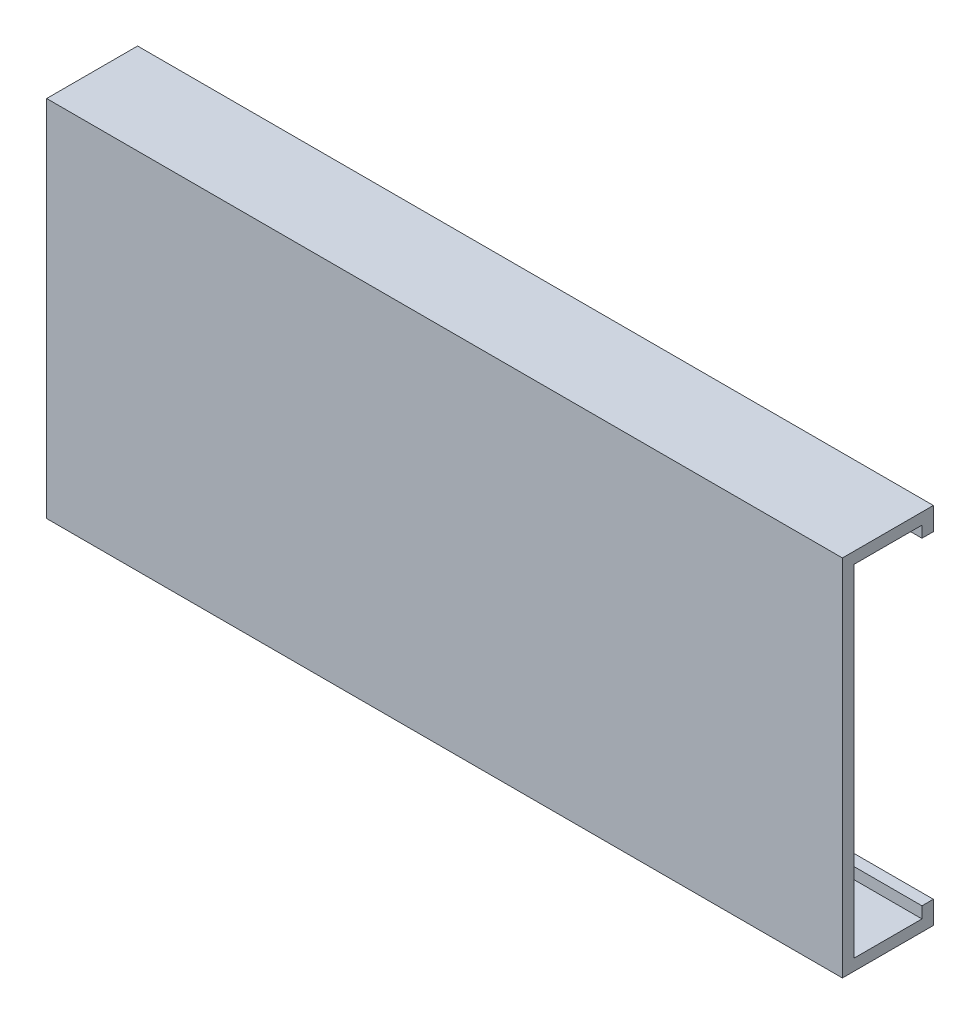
SolidWorks part; units mm, degrees
ref_plane "Front Plane" through (0, 0, 0) normal (0, 0, 1) x (1, 0, 0)
ref_plane "Top Plane" through (0, 0, 0) normal (0, 1, 0) x (1, 0, 0)
ref_plane "Right Plane" through (0, 0, 0) normal (1, 0, 0) x (0, 0, -1)
sketch "Sketch1" plane through (0, 0, 0) normal (0, 0, 1) x (1, 0, 0)
  line L1 (-35, -15) -> (35, -15)
  line L2 (-35, -15) -> (-35, 15)
  line L3 (-35, 15) -> (35, 15)
  line L4 (35, -15) -> (35, 15)
  line L5 (-35, -15) -> (35, 15) construction
  line L6 (-35, 15) -> (35, -15) construction
  point P0 (0, 0)
  dimension "D1" = 30
  dimension "D2" = 70
extrude "Boss-Extrude1" add sketch "Sketch1" along normal blind 1
sketch "Sketch2" plane through (0, 15, 0) normal (0, 1, 0) x (1, 0, 0)
  line L0 (35, -1) -> (35, 0) construction
  line L1 (-35, -1) -> (35, -1)
  line L2 (-35, -1) -> (-35, 7)
  line L3 (-35, 7) -> (35, 7)
  line L4 (35, -1) -> (35, 7)
  dimension "D1" = 8
extrude "Boss-Extrude2" add sketch "Sketch2" along normal blind 1 contours L3 L4 L1 L2
sketch "Sketch3" plane through (0, 0, 0) normal (0, 0, -1) x (-1, 0, 0)
  line L0 (35, 15) -> (35, -15) construction
  line L1 (-35, -15) -> (35, -15)
  line L2 (-35, -15) -> (-35, -16)
  line L3 (-35, -16) -> (35, -16)
  line L4 (35, -15) -> (35, -16)
  dimension "D1" = 1
extrude "Boss-Extrude3" add sketch "Sketch3" along normal blind 7 and the other way blind 1
sketch "Sketch4" plane through (35, 0, 0) normal (1, 0, 0) x (0, 0, -1)
  line L0 (0, -15) -> (7, -15) construction
  line L1 (7, 15) -> (6, 15)
  line L2 (7, 15) -> (7, 14)
  line L3 (7, 14) -> (6, 14)
  line L4 (6, 15) -> (6, 14)
  line L5 (7, -15) -> (6, -15)
  line L6 (7, -15) -> (7, -14)
  line L7 (7, -14) -> (6, -14)
  line L8 (6, -15) -> (6, -14)
  line L9 (7, -15) -> (7, -16) construction
  line L10 (7, 16) -> (7, 15) construction
  dimension "D1" = 1
  dimension "D2" = 1
  dimension "D3" = 1
  dimension "D4" = 1
extrude "Boss-Extrude4" add sketch "Sketch4" against normal up to vertex (70 mm away)
